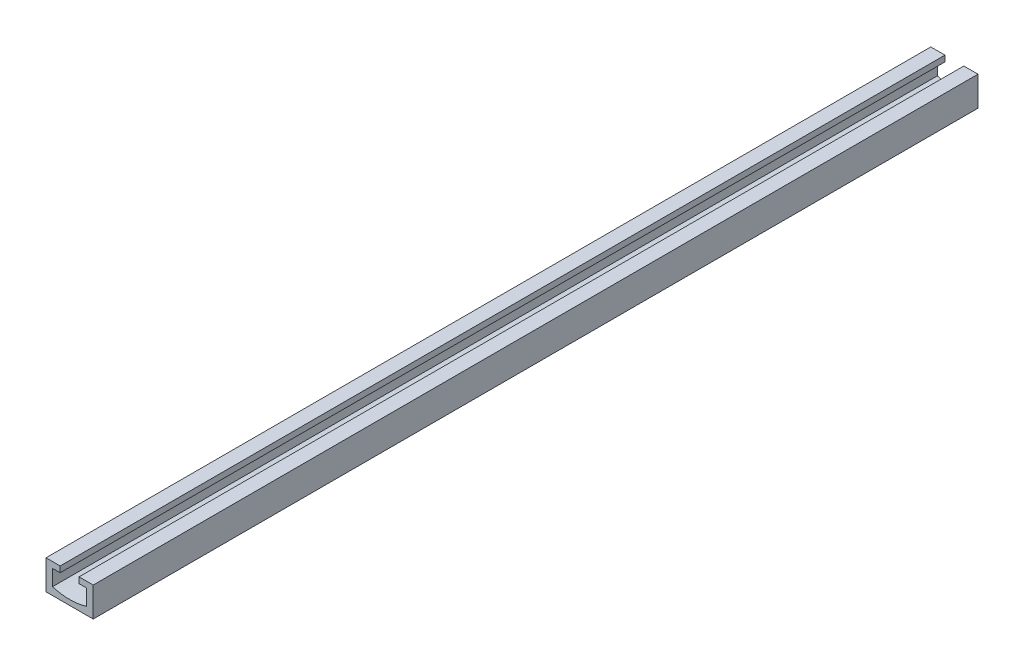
SolidWorks part; units mm, degrees
ref_plane "前视基准面" through (0, 0, 0) normal (0, 0, 1) x (1, 0, 0)
ref_plane "上视基准面" through (0, 0, 0) normal (0, 1, 0) x (1, 0, 0)
ref_plane "右视基准面" through (0, 0, 0) normal (1, 0, 0) x (0, 0, -1)
sketch "草图1" plane through (0, 0, 0) normal (0, 0, 1) x (1, 0, 0)
  line L1 (-4, -2.5) -> (4, -2.5)
  line L2 (-4, -2.5) -> (-4, 2.5)
  line L3 (-4, 2.5) -> (4, 2.5)
  line L4 (4, -2.5) -> (4, 2.5)
  line L5 (-4, -2.5) -> (4, 2.5) construction
  line L6 (-4, 2.5) -> (4, -2.5) construction
  point P0 (0, 0)
  dimension "D1" = 8
  dimension "D2" = 5
extrude "凸台-拉伸1" add sketch "草图1" along normal mid plane 150
sketch "草图2" plane through (0, 0, 75) normal (0, 0, 1) x (1, 0, 0)
  line L0 (0, 2.5) -> (0, -3.7958) construction
  line L1 (4, 2.5) -> (-4, 2.5) construction
  line L2 (-1.6, 2.5) -> (1.6, 2.5)
  line L3 (1.6, 2.5) -> (1.6, 1.5)
  line L4 (1.6, 1.5) -> (2.9, 1.5)
  line L5 (2.9, 1.5) -> (2.9, -1.2)
  line L6 (-2.9, 1.5) -> (-2.9, -1.2)
  line L7 (-1.6, 1.5) -> (-2.9, 1.5)
  line L8 (-1.6, 2.5) -> (-1.6, 1.5)
  arc A0 (-2.9, -1.2) -> (2.9, -1.2) centre (0, 8.3703) ccw
  dimension "D5" = 10
  dimension "D1" = 3.2
  dimension "D2" = 5.8
  dimension "D3" = 1
  dimension "D4" = 2.7
extrude "切除-拉伸1" cut sketch "草图2" against normal through all
sketch "草图3" plane through (0, -2.5, 0) normal (0, -1, 0) x (1, 0, 0)
  line L0 (0, 75) -> (0, 50) construction
  line L1 (-4, 75) -> (4, 75) construction
  line L2 (-4, -75) -> (4, -75) construction
  circle A0 centre (0, 50) radius 1.5
  circle A1 centre (0, -50) radius 1.5
  dimension "D1" = 3
  dimension "D3" = 25
  dimension "D2" = 25
extrude "切除-拉伸2" cut sketch "草图3" against normal through all
chamfer "倒角1" distance 0.5 angle 45 2 edges at (-0.3261, -1.6244, 51.4641) (-0.3261, -1.6244, -48.5359)
